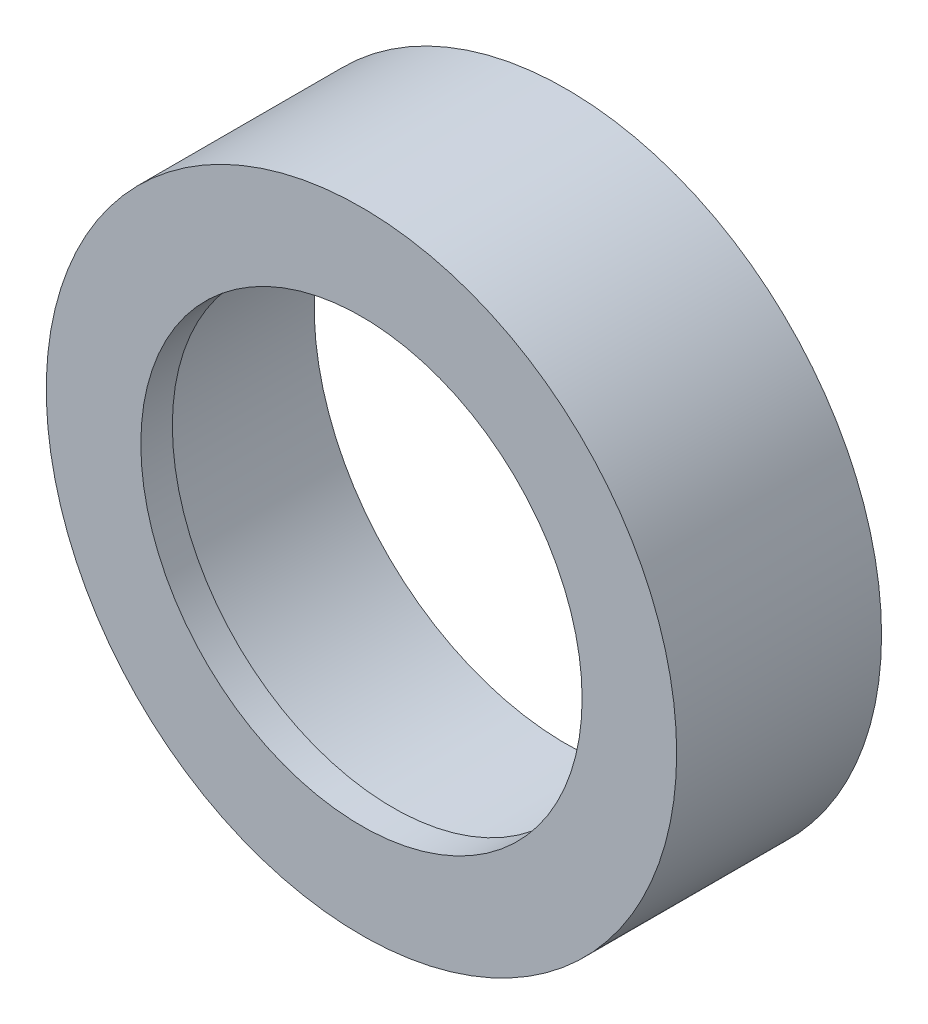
SolidWorks part; units mm, degrees
ref_plane "Plan de face" through (0, 0, 0) normal (0, 0, 1) x (1, 0, 0)
ref_plane "Plan de dessus" through (0, 0, 0) normal (0, 1, 0) x (1, 0, 0)
ref_plane "Plan de droite" through (0, 0, 0) normal (1, 0, 0) x (0, 0, -1)
sketch "Esquisse2" plane through (0, 0, 0) normal (1, 0, 0) x (0, 0, -1)
  line L0 (0, 14) -> (0, 20)
  line L1 (0, 20) -> (13, 20)
  line L2 (13, 20) -> (13, 16)
  line L3 (13, 16) -> (2, 16)
  line L4 (2, 16) -> (2, 14)
  line L5 (2, 14) -> (0, 14)
  line L6 (0, 0) -> (15.8391, 0) construction
  dimension "D1" = 20
  dimension "D2" = 14
  dimension "D3" = 2
  dimension "D4" = 13
  dimension "D5" = 16
revolve "Révolution1" add sketch "Esquisse2" angle 360 about L6
